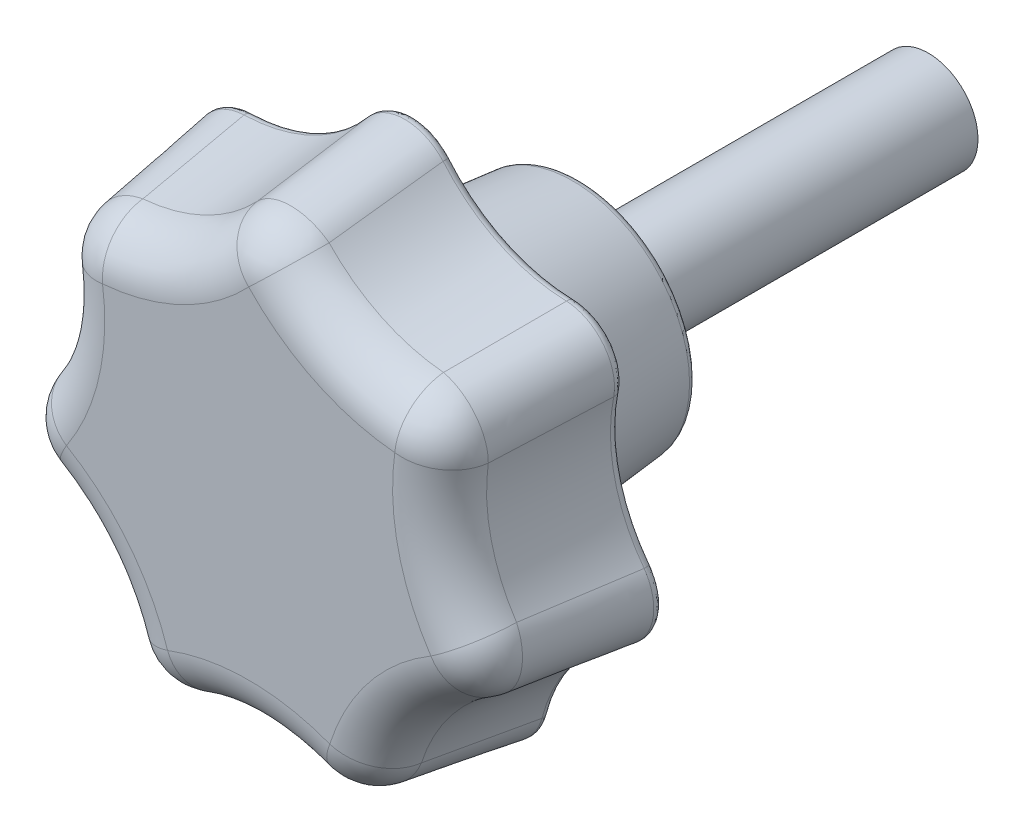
SolidWorks part; units mm, degrees
ref_plane "Front Plane" through (0, 0, 0) normal (0, 0, 1) x (1, 0, 0)
ref_plane "Top Plane" through (0, 0, 0) normal (0, 1, 0) x (1, 0, 0)
ref_plane "Right Plane" through (0, 0, 0) normal (1, 0, 0) x (0, 0, -1)
imported_body "Imported4"
sketch "Sketch1" plane through (0, 0, 0) normal (0, 1, 0) x (1, 0, 0)
  line L0 (3, 31) -> (0, 31)
  line L1 (0, 31) -> (0, 0)
  line L2 (0, 0) -> (8.051, 0)
  line L3 (8.051, 0) -> (7, 10)
  line L4 (7, 10) -> (3, 10)
  line L5 (3, 10) -> (3, 31)
  line L6 (0, 31) -> (0, 0) construction
revolve "Revolve1" add sketch "Sketch1" angle 360 about L6
fillet "Fillet1" radius 0.5 2 edges at (8.051, 0, 0) (7, 0, -10)
